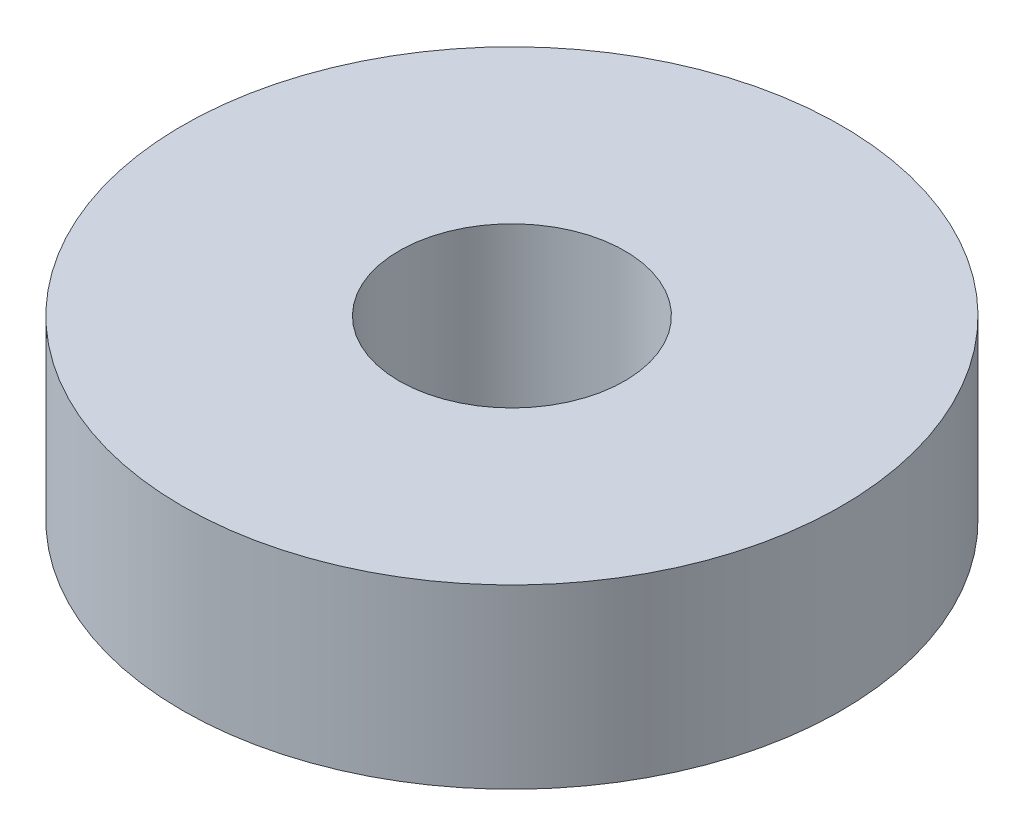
SolidWorks part; units mm, degrees
ref_plane "Front Plane" through (0, 0, 0) normal (0, 0, 1) x (1, 0, 0)
ref_plane "Top Plane" through (0, 0, 0) normal (0, 1, 0) x (1, 0, 0)
ref_plane "Right Plane" through (0, 0, 0) normal (1, 0, 0) x (0, 0, -1)
sketch "Sketch1" plane through (0, 0, 0) normal (0, 1, 0) x (1, 0, 0)
  circle A0 centre (0, 0) radius 3.2385
  circle A1 centre (0, 0) radius 9.4615
  dimension "D1" = 6.477
  dimension "D2" = 18.923
extrude "Boss-Extrude1" add sketch "Sketch1" along normal blind 5.08
